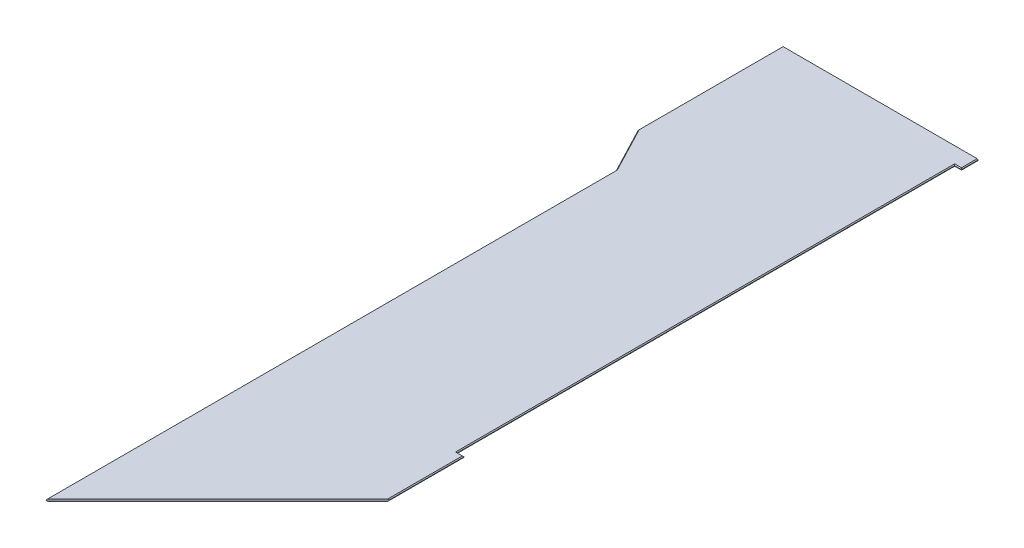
SolidWorks part; units mm, degrees
ref_plane "Front Plane" through (0, 0, 0) normal (1, 0, 0) x (0, 1, 0)
ref_plane "Top Plane" through (0, 0, 0) normal (0, 0, 1) x (0, 1, 0)
ref_plane "Right Plane" through (0, 0, 0) normal (0, 1, 0) x (-1, 0, 0)
sketch "Sketch2"
sketch_block_instance "Block4-1"
sketch_block "Block4" parameters "D1"=6, "D2"=6
extrude "Boss-Extrude2" add sketch "Sketch2" along normal mid plane 12.7
chamfer "Chamfer1" distance 5 angle 45 16 edges at (-487.0608, -6.35, 759.0185) (-559.6545, -6.35, -1106.1244) (-632.2483, -6.35, -1681.2829) (-487.0608, 6.35, 759.0185) (-559.6545, 6.35, -1106.1244) (-632.2483, 6.35, -1681.2829) (552.5517, -6.35, -2067.5462) (532.0017, -6.35, -2017.5462) (511.4517, -6.35, -511.5462) (532.0017, -6.35, 994.4538) (552.5517, -6.35, 1220.0538) (552.5517, 6.35, -2067.5462) (532.0017, 6.35, -2017.5462) (511.4517, 6.35, -511.5462) (532.0017, 6.35, 994.4538) (552.5517, 6.35, 1220.0538)
